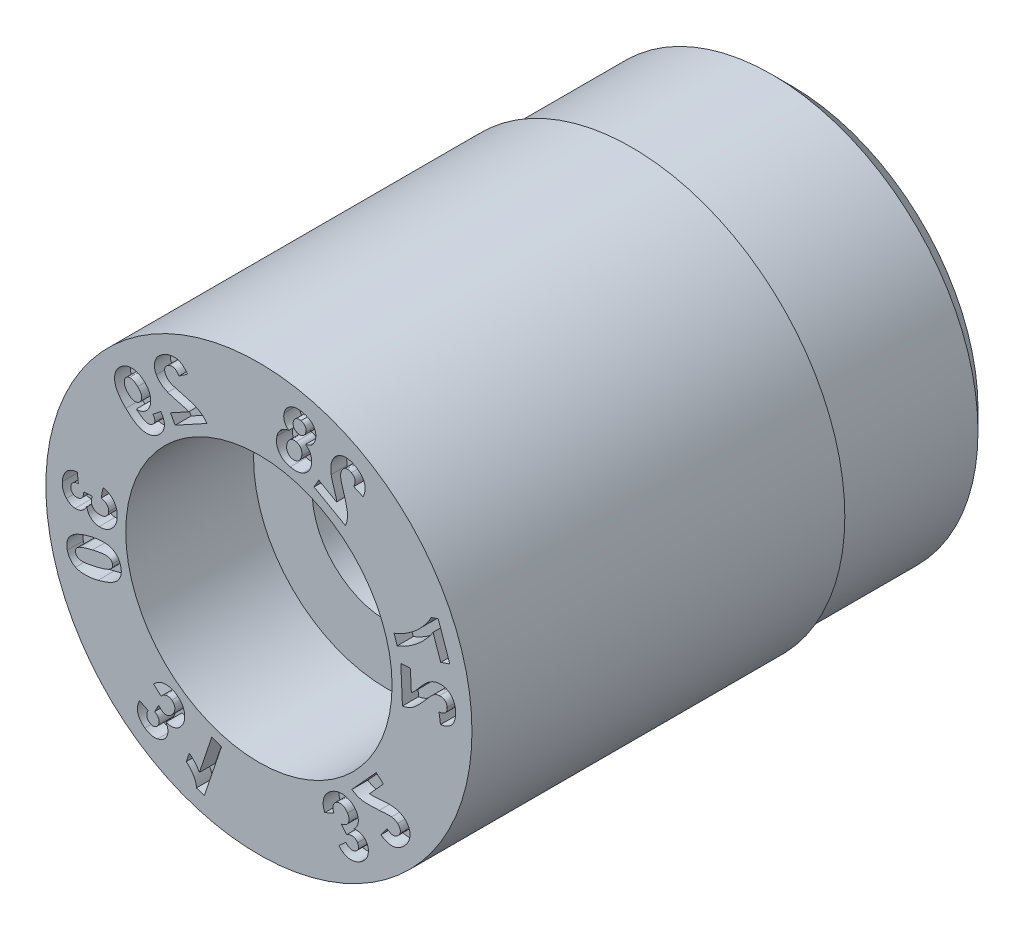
SolidWorks part; units mm, degrees
ref_plane "Front Plane" through (0, 0, 0) normal (0, 0, 1) x (1, 0, 0)
ref_plane "Top Plane" through (0, 0, 0) normal (0, 1, 0) x (1, 0, 0)
ref_plane "Right Plane" through (0, 0, 0) normal (1, 0, 0) x (0, 0, -1)
sketch "Sketch1" plane through (0, 0, 0) normal (1, 0, 0) x (0, 0, -1)
  line L2 (0, 2) -> (0, 1.25)
  line L3 (4.75, 2) -> (0, 2)
  line L4 (-3.7979, 0) -> (49996.2021, 0) construction
  line L8 (5, 0.7) -> (1.2, 0.7)
  line L9 (1.2, 1.25) -> (1.2, 0.7)
  line L10 (1.2, 1.25) -> (0, 1.25)
  line L12 (5, 0.7) -> (5, 1.75)
  line L16 (5, 1.75) -> (4.75, 2)
  dimension "D1" = 5
  dimension "D2" = 45
  dimension "D3" = 0.25
  dimension "D4" = 4
  dimension "D5" = 2.5
  dimension "D6" = 1.2
  dimension "D7" = 1.4
revolve "Revolve1" add sketch "Sketch1" angle 360 about L4
sketch "Sketch5" plane through (0, 0, 0) normal (1, 0, 0) x (0, 0, -1)
  line L0 (0, 0) -> (50000, 0) construction
  line L1 (0, 2) -> (0, -2) construction
  line L2 (3.5, 1.935) -> (5, 1.935)
  line L3 (3.5, 1.935) -> (3.5, 2.935)
  line L4 (3.5, 2.935) -> (5, 2.935)
  line L5 (5, 1.935) -> (5, 2.935)
  line L6 (5, -1.75) -> (5, 1.75) construction
  line L7 (4.75, 2) -> (0, 2) construction
  dimension "D1" = 3.5
  dimension "D2" = 0.065
  dimension "D3" = 1
revolve "Cut-Revolve1" cut sketch "Sketch5" angle 360 about L0
sketch "Sketch7" plane through (0, 0, 0) normal (0, 0, 1) x (1, 0, 0)
  arc A0 (1.3481, -0.1356) -> (1.3076, -0.3549) centre (0, 0) ccw construction
  text T0 "27   28   29   30   31    32" font "Arial" height 0.51
  dimension "D1" = 1.3549
extrude "Cut-Extrude1" cut sketch "Sketch7" against normal blind 0.15
